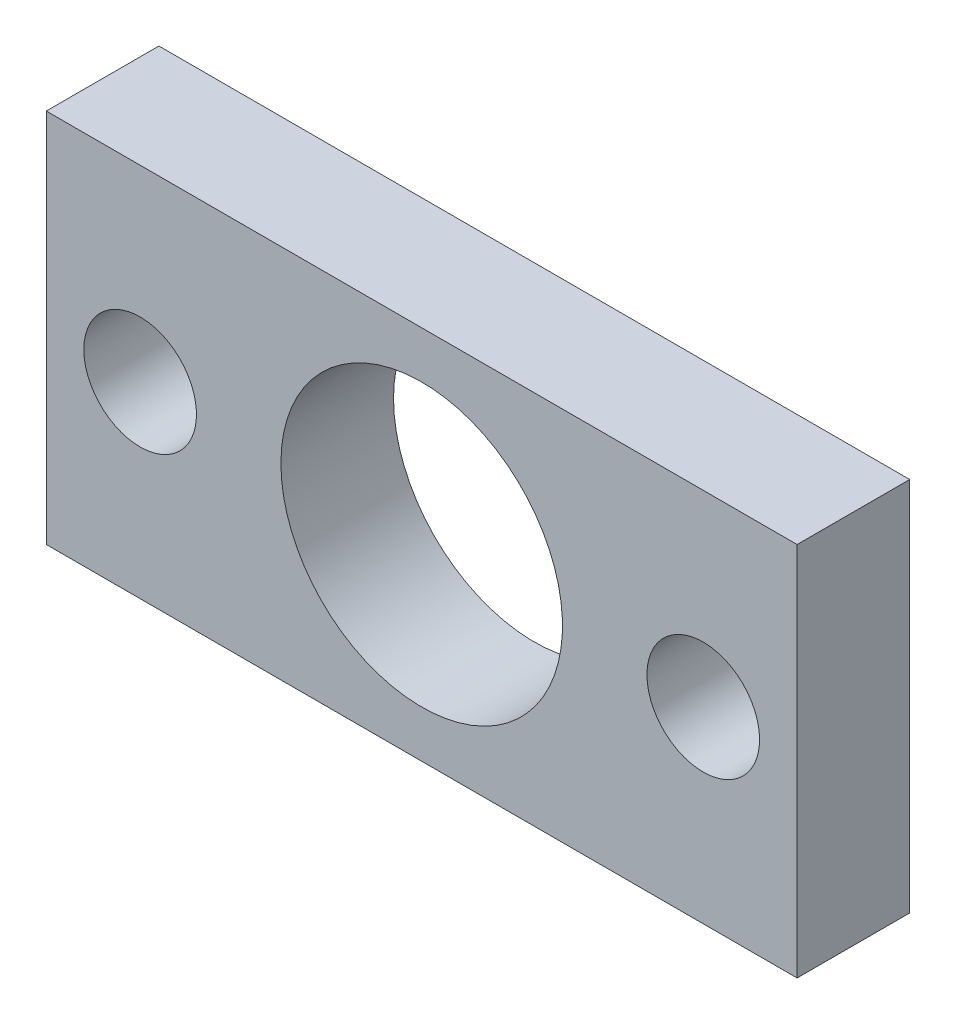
SolidWorks part; units mm, degrees
ref_plane "Front Plane" through (0, 0, 0) normal (0, 0, 1) x (1, 0, 0)
ref_plane "Top Plane" through (0, 0, 0) normal (0, 1, 0) x (1, 0, 0)
ref_plane "Right Plane" through (0, 0, 0) normal (1, 0, 0) x (0, 0, -1)
ref_plane "Plane1" through (0, 0, -6.35) normal (0, 0, -1) x (-1, 0, 0)
sketch "Sketch1" plane through (0, 0, -6.35) normal (0, 0, -1) x (-1, 0, 0)
  line L0 (-25.4, 12.7) -> (-25.4, 0)
  line L1 (-25.4, 0) -> (0, 0)
  line L2 (0, 0) -> (0, 12.7)
  line L3 (0, 12.7) -> (-25.4, 12.7)
  circle A0 centre (-22.225, 6.35) radius 1.905
  circle A1 centre (-3.175, 6.35) radius 1.905
  circle A2 centre (-12.7, 6.35) radius 4.7625
extrude "Boss-Extrude1" add sketch "Sketch1" against normal blind 3.81
